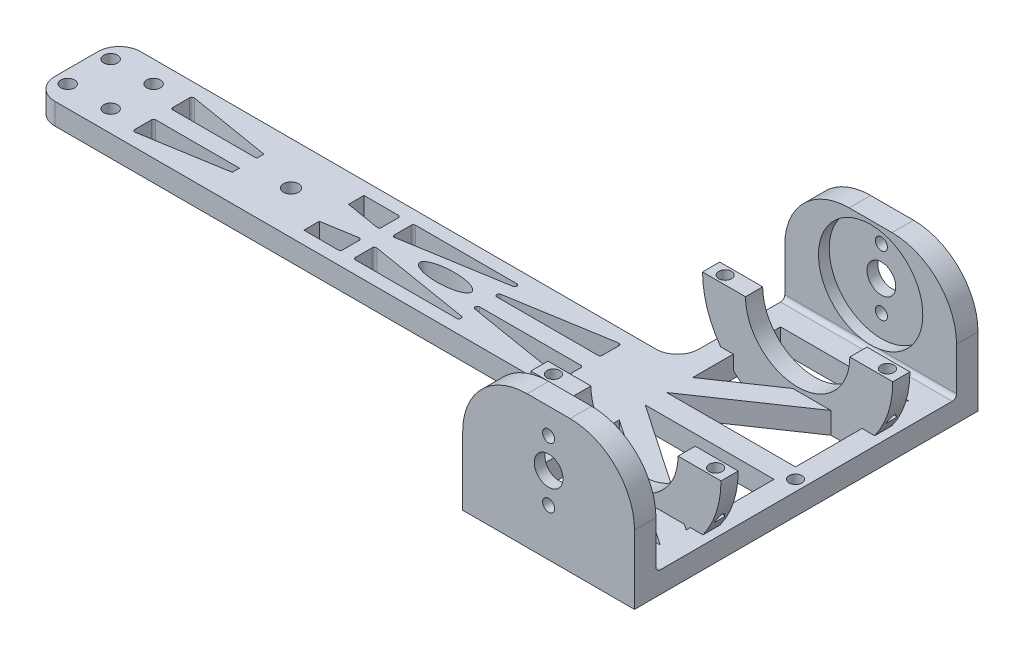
SolidWorks part; units mm, degrees
ref_plane "Front Plane" through (0, 0, 0) normal (0, 0, 1) x (1, 0, 0)
ref_plane "Top Plane" through (0, 0, 0) normal (0, 1, 0) x (1, 0, 0)
ref_plane "Right Plane" through (0, 0, 0) normal (1, 0, 0) x (0, 0, -1)
sketch "Sketch1" plane through (0, 0, 0) normal (0, 1, 0) x (1, 0, 0)
  line L0 (0, -10) -> (-130, -10)
  line L1 (0, 0) -> (40, 0) construction
  line L2 (0, 0) -> (0, -40) construction
  line L3 (0, -40) -> (40, -40) construction
  line L4 (40, 0) -> (40, -40) construction
  line L5 (-130, -10) -> (-130, 0)
  line L6 (-55, 0) -> (55, 0) construction
  line L7 (-130, 0) -> (40, 0)
  line L8 (40, 0) -> (40, -40)
  line L9 (40, -40) -> (0, -40)
  line L10 (0, -40) -> (0, -10)
  dimension "D1" = 130
  dimension "D2" = 40
  dimension "D3" = 10
  dimension "D4" = 40
extrude "Main Chassis Extrude" add sketch "Sketch1" along normal blind 5
fillet "Fillet1" radius 5 2 edges at (0, 2.5, 10) (-130, 2.5, 10)
sketch "Sketch3" plane through (0, 0, 40) normal (0, 0, 1) x (1, 0, 0)
  line L0 (0, -55) -> (0, 55) construction
  line L1 (40, 5) -> (0, 5)
  line L2 (40, 5) -> (40, 31)
  line L3 (40, 31) -> (0, 31)
  line L4 (0, 5) -> (0, 31)
  line L5 (20, 31) -> (20, 5) construction
  line L6 (0, 18) -> (40, 18) construction
  circle A0 centre (20, 25) radius 1.4
  circle A1 centre (20, 11) radius 1.4
  circle A2 centre (20, 18) radius 3.35
  dimension "D2" = 2.8
  dimension "D4" = 6.7
  dimension "D1" = 26
  dimension "D3" = 14
extrude "Motor Brace Extrusion" add sketch "Sketch3" against normal blind 5
fillet "Fillet2" radius 1 1 edges at (20, 5, 35)
sketch "Sketch4" plane through (0, 0, 35) normal (0, 0, -1) x (-1, 0, 0)
  circle A0 centre (-20, 18) radius 12.15
  dimension "D1" = 24.3
extrude "Motor Profile in brace extrusion" cut sketch "Sketch4" against normal blind 2.5 and the other way blind 1 contours A0
sketch "Sketch5" plane through (0, 5, 0) normal (0, 1, 0) x (1, 0, 0)
  line L0 (5, -2.5) -> (35, -2.5)
  line L1 (35, -2.5) -> (35, -22.9489)
  line L2 (35, -22.9489) -> (5, -2.5)
  line L3 (5, -8.5511) -> (35, -29)
  line L4 (35, -29) -> (5, -29)
  line L5 (5, -29) -> (5, -8.5511)
  line L6 (40, -34) -> (40, 0) construction
  line L7 (0, -17.05) -> (0, 17.05) construction
  line L8 (0, -34) -> (40, -34) construction
  line L9 (-17.05, 0) -> (17.05, 0) construction
  line L10 (-110, -10) -> (-110, 0) construction
  line L11 (-125, -10) -> (-5, -10) construction
  line L12 (-130, 0) -> (-130, -5) construction
  line L13 (-110, -7) -> (-79.8419, -2)
  line L14 (-79.8419, -2) -> (-110, -2)
  line L15 (-110, -2) -> (-110, -7)
  line L16 (-91.6581, -7) -> (-61.5, -2)
  line L17 (-61.5, -2) -> (-61.5, -7)
  line L18 (-61.5, -7) -> (-91.6581, -7)
  line L19 (-58.5, -2) -> (-58.5, -7)
  line L20 (-58.5, -7) -> (-28.3419, -7)
  line L21 (-28.3419, -7) -> (-58.5, -2)
  line L22 (-40.1581, -2) -> (-10, -7)
  line L23 (-10, -7) -> (-10, -2)
  line L24 (-10, -2) -> (-40.1581, -2)
  point P24 (5, -2.5)
  dimension "D1" = 5
  dimension "D2" = 5
  dimension "D3" = 5
  dimension "D4" = 5
  dimension "D5" = 2.5
  dimension "D8" = 20
  dimension "D9" = 2
  dimension "D10" = 3
  dimension "D11" = 3
  dimension "D12" = 3
  dimension "D13" = 3
  dimension "D14" = 10
extrude "Skeltonising Chassis" cut sketch "Sketch5" against normal through all
ref_plane "Plane1" through (0, 0, 20) normal (0, 0, 1) x (1, 0, 0)
sketch "Sketch13" plane through (0, 0, 20) normal (0, 0, 1) x (1, 0, 0)
  line L0 (42.15, 18) -> (32.15, 18)
  line L1 (7.85, 18) -> (-2.15, 18)
  circle A0 centre (20, 18) radius 12.15 construction
  arc A1 (32.15, 18) -> (7.85, 18) centre (20, 18) cw
  arc A2 (42.15, 18) -> (-2.15, 18) centre (20, 18) cw
  dimension "D1" = 24.3
  dimension "D2" = 10
extrude "Motor Clamp" add sketch "Sketch13" along normal mid plane 4
sketch "Sketch14" plane through (0, 18, 0) normal (0, 1, 0) x (1, 0, 0)
  line L0 (1.1, -20) -> (38.9, -20) construction
  line L1 (-19.3325, -20) -> (19.3325, -20) construction
  line L2 (20, -40) -> (20, 9.5619) construction
  line L3 (40, -40) -> (0, -40) construction
  circle A0 centre (1.1, -20) radius 1.5
  circle A1 centre (38.9, -20) radius 1.5
  dimension "D1" = 37.8
  dimension "D2" = 3
extrude "Cut-Extrude7" cut sketch "Sketch14" against normal blind 10
fillet "Fillet3" radius 0.5 12 edges at (-10, 2.5, 7) (-10, 2.5, 2) (-40.1581, 2.5, 2) (-28.3419, 2.5, 7) (-58.5, 2.5, 7) (-58.5, 2.5, 2) (-61.5, 2.5, 7) (-61.5, 2.5, 2) (-91.6581, 2.5, 7) (-79.8419, 2.5, 2) (-110, 2.5, 7) (-110, 2.5, 2)
fillet "Fillet4" radius 15 2 edges at (40, 31, 37.5) (0, 31, 37.5)
mirror "Mirror1" about plane through (0, 0, 0) normal (0, 0, 1)
sketch "Sketch2" plane through (0, 5, 0) normal (0, 1, 0) x (1, 0, 0)
  line L1 (-127, -5) -> (-117, -5) construction
  line L2 (-127, -5) -> (-127, 5) construction
  line L3 (-127, 5) -> (-117, 5) construction
  line L4 (-117, -5) -> (-117, 5) construction
  line L6 (-19.3325, 0) -> (19.3325, 0) construction
  line L9 (-130, 5) -> (-130, -5) construction
  circle A0 centre (-127, 5) radius 1.6
  circle A1 centre (-117, 5) radius 1.6
  circle A2 centre (-117, -5) radius 1.6
  circle A3 centre (-127, -5) radius 1.6
  point P4 (-127, 0)
  dimension "D3" = 3.2
  dimension "D1" = 10
  dimension "D2" = 3
extrude "Front PCB Mounting Holes" cut sketch "Sketch2" against normal through all contours A0
sketch "Sketch8" plane through (0, 5, 0) normal (0, 1, 0) x (1, 0, 0)
  line L0 (-19.3325, 0) -> (19.3325, 0) construction
  line L1 (-61.5, 4.5449) -> (-58.5, 4.5449) construction
  line L2 (-61.5, 6.5) -> (-61.5, 2.5897) construction
  line L3 (-58.5, 2.5897) -> (-58.5, 6.5) construction
  line L4 (-58.5, 4.5449) -> (-60, 4.5449) construction
  line L5 (-60, 4.5449) -> (-60, 10) construction
  ellipse E0 centre (-76, 0) end of major axis (-82, 0) minor radius 2
  ellipse E1 centre (-44, 0) end of major axis (-38, 0) minor radius 2
  dimension "D1" = 6
  dimension "D2" = 2
  dimension "D3" = 16
extrude "Cut-Extrude5" cut sketch "Sketch8" against normal through all
sketch "Sketch9" plane through (0, 0, 0) normal (0, -1, 0) x (1, 0, 0)
  line L0 (19.3325, 0) -> (-19.3325, 0) construction
  line L1 (-70, 10) -> (-90, 10)
  line L2 (-70, 10) -> (-70, -10)
  line L3 (-70, -10) -> (-90, -10)
  line L4 (-90, 10) -> (-90, -10)
  line L5 (-70, 10) -> (-90, -10) construction
  line L6 (-70, -10) -> (-90, 10) construction
  line L7 (-125, -10) -> (-5, -10) construction
  line L8 (-130, -5) -> (-130, 5) construction
  point P0 (-80, 0)
  dimension "D1" = 50
extrude "Boss-Extrude4" add sketch "Sketch9" against normal up to surface (5 mm away)
sketch "Sketch11" plane through (0, 5, 0) normal (0, 1, 0) x (1, 0, 0)
  line L0 (-19.3325, 0) -> (19.3325, 0) construction
  line L1 (-130, 5) -> (-130, -5) construction
  line L3 (40, -34) -> (40, 34) construction
  circle A0 centre (-80, 0) radius 1.75
  circle A1 centre (37.5, 0) radius 1.5
  dimension "D2" = 3.5
  dimension "D4" = 3
  dimension "D1" = 50
  dimension "D3" = 2.5
extrude "Cut-Extrude6" cut sketch "Sketch11" against normal through all both and the other way through all
sketch "Sketch15" plane through (40, 0, 0) normal (1, 0, 0) x (0, 0, -1)
  line L0 (40, 16) -> (40, 0) construction
  line L1 (-40, 0) -> (40, 0)
  line L2 (-40, 0) -> (-40, -10)
  line L3 (-40, -10) -> (40, -10)
  line L4 (40, 0) -> (40, -10)
  dimension "D1" = 10
extrude "Cut-Extrude8" cut sketch "Sketch15" against normal through all both and the other way through all
